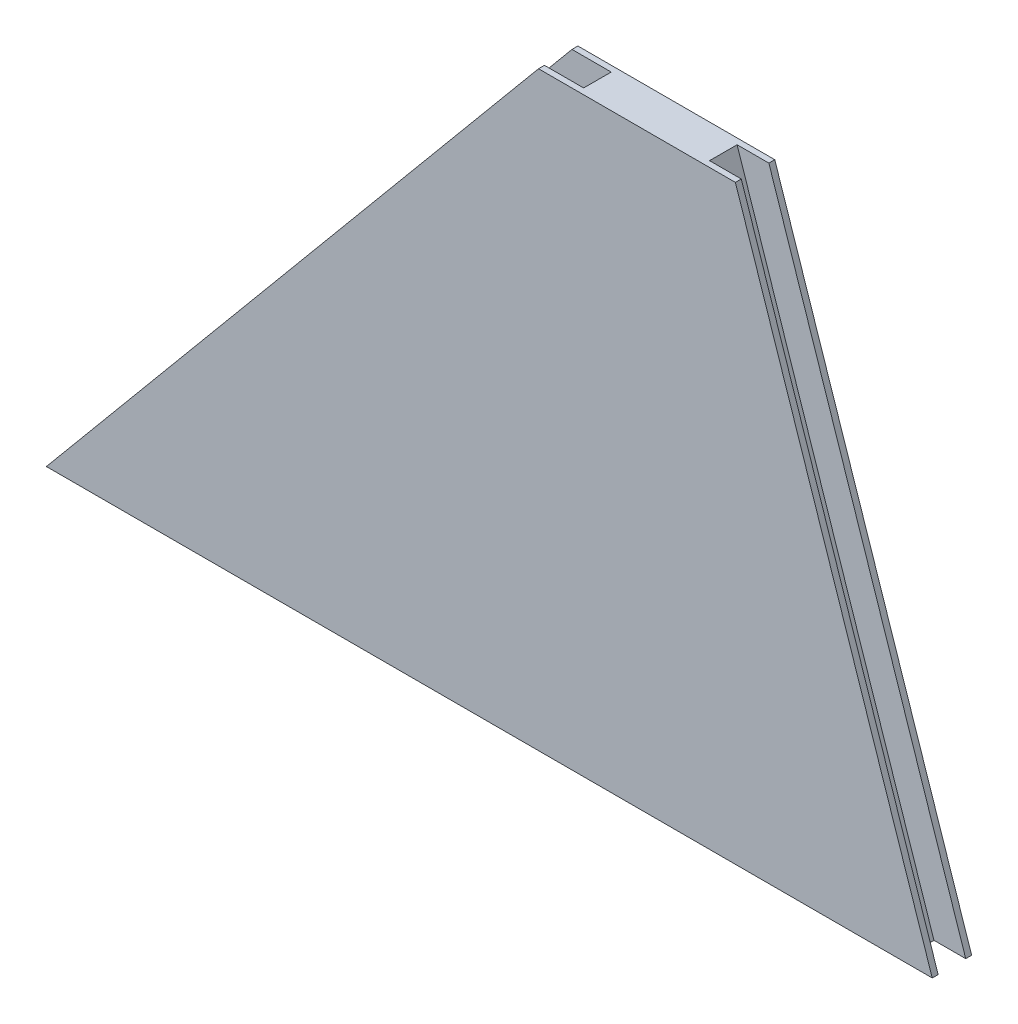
SolidWorks part; units mm, degrees
ref_plane "Front Plane" through (0, 0, 0) normal (0, 0, 1) x (1, 0, 0)
ref_plane "Top Plane" through (0, 0, 0) normal (0, 1, 0) x (1, 0, 0)
ref_plane "Right Plane" through (0, 0, 0) normal (1, 0, 0) x (0, 0, -1)
sketch "Sketch4" plane through (0, 0, 0) normal (0, 0, 1) x (1, 0, 0)
  line L6 (107.3385, 111.154) -> (18.4385, 111.154)
  line L8 (107.3385, 111.154) -> (132.7385, 111.154)
  line L12 (18.4385, 111.154) -> (81.9385, 187.354)
  line L13 (81.9385, 187.354) -> (107.3385, 187.354)
  line L14 (132.7385, 111.154) -> (107.3385, 187.354)
  dimension "D1" = 114.3
  dimension "D2" = 25.4
  dimension "D3" = 76.2
  dimension "D4" = 25.4
  dimension "D5" = 63.5
extrude "Extrude1" add sketch "Sketch4" along normal blind 5.08
sketch "Sketch8" plane through (152.8109, 50.937, 0) normal (0.9487, 0.3162, 0) x (0, 0, -1)
  line L0 (-5.08, 151.8284) -> (-5.08, 99.6192) construction
  line L1 (-0.762, 147.1007) -> (-4.318, 147.1007)
  line L2 (-0.762, 147.1007) -> (-0.762, 63.0797)
  line L3 (-0.762, 63.0797) -> (-4.318, 63.0797)
  line L4 (-4.318, 147.1007) -> (-4.318, 63.0797)
  dimension "D1" = 3.556
  dimension "D2" = 0.762
extrude "Cut-Extrude1" cut sketch "Sketch8" against normal blind 3.8862
sketch "Sketch9" plane through (-43.7842, 36.4868, 0) normal (-0.7682, 0.6402, 0) x (0, 0, 1)
  line L0 (5.08, 196.3851) -> (5.08, 97.1949) construction
  line L1 (0.762, 218.1715) -> (4.318, 218.1715)
  line L2 (0.762, 218.1715) -> (0.762, 95.2505)
  line L3 (0.762, 95.2505) -> (4.318, 95.2505)
  line L4 (4.318, 218.1715) -> (4.318, 95.2505)
  dimension "D1" = 3.556
  dimension "D2" = 0.762
extrude "Cut-Extrude2" cut sketch "Sketch9" against normal blind 3.8862
